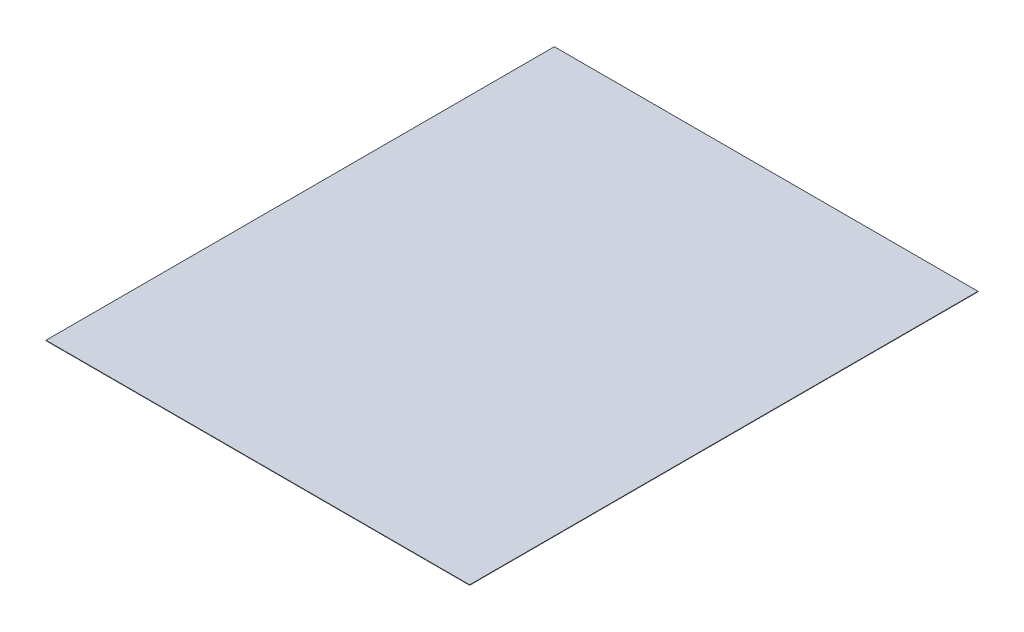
SolidWorks part; units mm, degrees
ref_plane "Front Plane" through (0, 0, 0) normal (0, 0, 1) x (1, 0, 0)
ref_plane "Top Plane" through (0, 0, 0) normal (0, 1, 0) x (1, 0, 0)
ref_plane "Right Plane" through (0, 0, 0) normal (1, 0, 0) x (0, 0, -1)
sketch "Sketch1" plane through (0, 0, 0) normal (0, 1, 0) x (1, 0, 0)
  line L1 (-12700, -15240) -> (12700, -15240)
  line L2 (-12700, -15240) -> (-12700, 15240)
  line L3 (-12700, 15240) -> (12700, 15240)
  line L4 (12700, -15240) -> (12700, 15240)
  line L5 (-12700, -15240) -> (12700, 15240) construction
  line L6 (-12700, 15240) -> (12700, -15240) construction
  point P0 (0, 0)
  dimension "D1" = 25400
  dimension "D2" = 30480
extrude "Boss-Extrude1" add sketch "Sketch1" along normal blind 25.4
